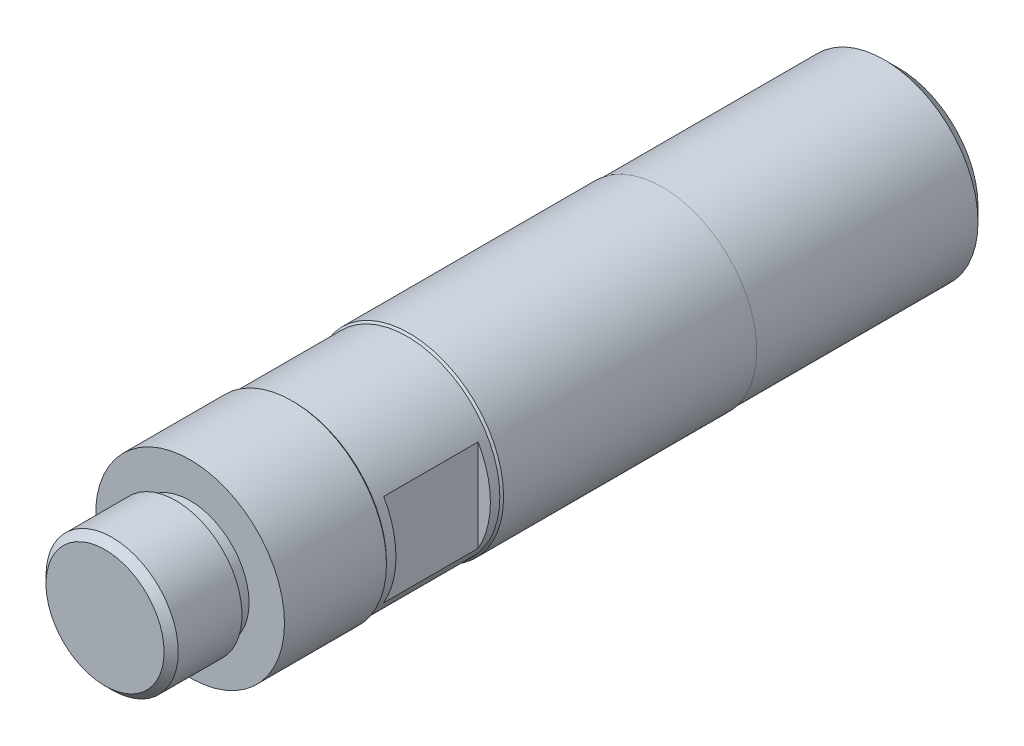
SolidWorks part; units mm, degrees
ref_plane "Face" through (0, 0, 0) normal (0, 0, 1) x (1, 0, 0)
ref_plane "Dessus" through (0, 0, 0) normal (0, 1, 0) x (1, 0, 0)
ref_plane "Droite" through (0, 0, 0) normal (1, 0, 0) x (0, 0, -1)
sketch "Esquisse1" plane through (0, 0, 0) normal (0, 0, 1) x (1, 0, 0)
  circle A0 centre (0, 0) radius 10
  dimension "D1" = 20
extrude "Base-Extrusion" add sketch "Esquisse1" along normal blind 75
sketch "Esquisse2" plane through (0, 0, 75) normal (0, 0, 1) x (1, 0, 0)
  circle A0 centre (0, 0) radius 7
extrude "Boss.-Extru.1" add sketch "Esquisse2" along normal blind 9
chamfer "Chanfrein1" distance 0.75 angle 45 1 edges at (7, 0, 84)
sketch "Esquisse3" plane through (0, 0, 0) normal (0, 1, 0) x (1, 0, 0)
  line L1 (0, 0) -> (0, -96.1118) construction
  line L3 (-10, 0) -> (-10, -75) construction
  line L4 (-10, -53) -> (-8.5, -53)
  line L5 (-10, -53) -> (-10, -63)
  line L6 (-10, -63) -> (-8.5, -63)
  line L7 (-8.5, -53) -> (-8.5, -63)
  line L8 (-10, -75) -> (10, -75) construction
  line L9 (8.5, -53) -> (8.5, -63)
  line L10 (10, -63) -> (8.5, -63)
  line L11 (10, -53) -> (10, -63)
  line L12 (10, -53) -> (8.5, -53)
  dimension "D1" = 17
  dimension "D2" = 10
  dimension "D3" = 12
extrude "Enlèv. mat.-Extru.1" cut sketch "Esquisse3" along normal mid plane 39
sketch "Esquisse4" plane through (0, 0, 0) normal (0, 1, 0) x (1, 0, 0)
  line L0 (-10, -75) -> (10, -75) construction
  line L1 (-10, -75) -> (-6.25, -75)
  line L2 (-10, -75) -> (-10, -76.5)
  line L3 (-10, -76.5) -> (-6.25, -76.5)
  line L4 (-6.25, -75) -> (-6.25, -76.5)
  line L6 (0, -83.9082) -> (0, -54.9506) construction
  line L7 (0, -75) -> (0, 0) construction
  line L8 (-10, -63) -> (-10, -75) construction
  dimension "D1" = 1.5
  dimension "D2" = 12.5
revolve "Enlèvement de matière-Révolution1" cut sketch "Esquisse4" angle 360 about L6
sketch "Esquisse5" plane through (0, 0, 0) normal (1, 0, 0) x (0, 0, -1)
  line L0 (-84, 0) -> (-39.517, 0) construction
  line L1 (-84, 6.25) -> (-84, -6.25) construction
  line L2 (-64.2, 10) -> (-64, 9.8)
  line L3 (0, 10) -> (-75, 10) construction
  line L4 (-64, 9.8) -> (-52, 9.8)
  line L5 (-52, 9.8) -> (-51.8, 10)
  line L6 (-51.8, 10) -> (-64.2, 10)
  line L7 (-58, 0) -> (-58, 9.8) construction
  line L8 (-53, 5.2678) -> (-53, -5.2678) construction
  line L9 (-63, -5.2678) -> (-63, 5.2678) construction
  dimension "D1" = 45
  dimension "D2" = 45
  dimension "D3" = 12
  dimension "D4" = 19.6
revolve "Enlèvement de matière-Révolution2" cut sketch "Esquisse5" angle 360 about L0
sketch "Esquisse6" plane through (0, 0, 0) normal (1, 0, 0) x (0, 0, -1)
  line L0 (-84, 0) -> (0, 0) construction
  line L1 (-84, 6.25) -> (-84, -6.25) construction
  line L2 (0, 10) -> (-51.8, 10) construction
  line L3 (-25, 10) -> (0, 10)
  line L4 (-25, 10) -> (-25, 9.925)
  line L5 (-25, 9.925) -> (0, 9.925)
  line L6 (0, 10) -> (0, 9.925)
  line L8 (0, -10) -> (0, 10) construction
  dimension "D1" = 19.85
  dimension "D2" = 25
revolve "Enlèvement de matière-Révolution3" cut sketch "Esquisse6" angle 360 about L0
chamfer "Chanfrein2" distance 1.5 angle 45 1 edges at (9.925, 0, 0)
thread "Filetage1" pitch 1.5 start angle 0, offset 5, length 0, pitch 1.5, diameter 14
ref_plane "Plan1" through (-7, 0, 88.25) normal (0, -1, 0) x (-1, 0, 0)
sketch "Profil de filetage1" plane through (-7, 0, 88.25) normal (0, -1, 0) x (-1, 0, 0)
  line L0 (0, 0) -> (0, 1.5) construction
  line L11 (0, 0) -> (0, 1.3125)
  line L12 (0, 1.3125) -> (-0.8119, 0.8437)
  line L13 (-0.8119, 0.8437) -> (-0.8119, 0.4687)
  line L15 (-0.8119, 0.4687) -> (0, 0)
  line L17 (-0.8119, 0.6562) -> (0, 0.6562) construction
  point P2 (0, 0)
  dimension "Pitch" = 1.5
  dimension "Profile_Angle" = 60
  dimension "Profile_Land" = 0.375
  dimension "Profile_Height" = 0.8119
thread "Filetage2" pitch 2.5 start angle 0, offset 5, length 0, pitch 2.5, diameter 19.85
ref_plane "Plan2" through (9.925, 0, -3.5) normal (0, -1, 0) x (1, 0, 0)
sketch "Profil de filetage2" plane through (9.925, 0, -3.5) normal (0, -1, 0) x (1, 0, 0)
  line L0 (0, 0) -> (0, 2.5) construction
  line L11 (0, 0) -> (0, 2.1875)
  line L12 (0, 2.1875) -> (-1.3532, 1.4062)
  line L13 (-1.3532, 1.4062) -> (-1.3532, 0.7812)
  line L15 (-1.3532, 0.7812) -> (0, 0)
  line L17 (-1.3532, 1.0937) -> (0, 1.0937) construction
  point P2 (0, 0)
  dimension "Pitch" = 2.5
  dimension "Profile_Angle" = 60
  dimension "Profile_Land" = 0.625
  dimension "Profile_Height" = 1.3532
